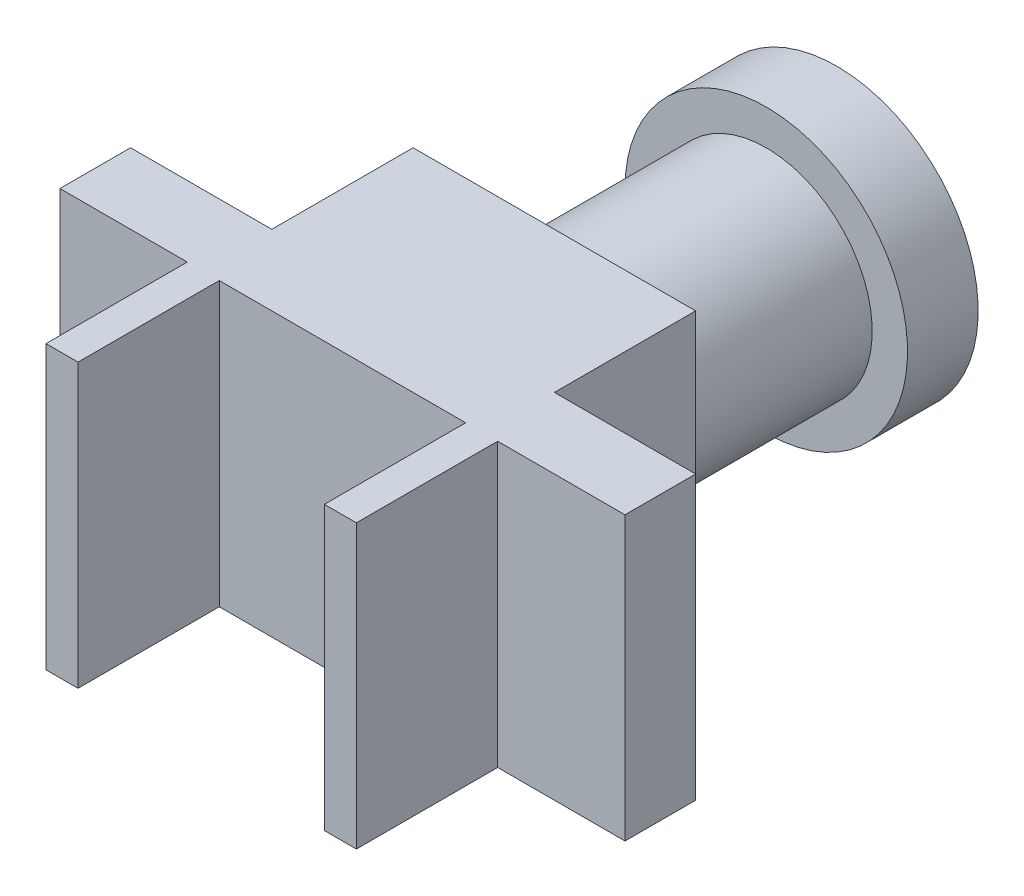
SolidWorks part; units mm, degrees
ref_plane "Front Plane" through (0, 0, 0) normal (0, 0, 1) x (1, 0, 0)
ref_plane "Top Plane" through (0, 0, 0) normal (0, 1, 0) x (1, 0, 0)
ref_plane "Right Plane" through (0, 0, 0) normal (1, 0, 0) x (0, 0, -1)
sketch "Sketch1" plane through (0, 0, 0) normal (0, 0, 1) x (1, 0, 0)
  circle A0 centre (0, 0) radius 15
  dimension "D1" = 30
extrude "Boss-Extrude1" add sketch "Sketch1" along normal mid plane 30
sketch "Sketch2" plane through (0, 0, -15) normal (0, 0, -1) x (-1, 0, 0)
  circle A2 centre (0, 0) radius 20
  circle A3 centre (0, 0) radius 20
  dimension "D1" = 5
extrude "Boss-Extrude2" add sketch "Sketch2" along normal blind 10
sketch "Sketch3" plane through (0, 0, 15) normal (0, 0, 1) x (1, 0, 0)
  line L1 (20, 20) -> (-20, 20)
  line L2 (20, 20) -> (20, -20)
  line L3 (20, -20) -> (-20, -20)
  line L4 (-20, 20) -> (-20, -20)
  line L5 (20, 20) -> (-20, -20) construction
  line L6 (20, -20) -> (-20, 20) construction
  point P0 (0, 0)
  dimension "D1" = 40
  dimension "D2" = 40
extrude "Boss-Extrude3" add sketch "Sketch3" along normal blind 20
sketch "Sketch4" plane through (0, 0, 35) normal (0, 0, 1) x (1, 0, 0)
  line L1 (40, 20) -> (-40, 20)
  line L2 (40, 20) -> (40, -20)
  line L3 (40, -20) -> (-40, -20)
  line L4 (-40, 20) -> (-40, -20)
  line L5 (40, 20) -> (-40, -20) construction
  line L6 (40, -20) -> (-40, 20) construction
  point P0 (0, 0)
  dimension "D1" = 40
  dimension "D2" = 80
extrude "Boss-Extrude4" add sketch "Sketch4" along normal blind 10
sketch "Sketch5" plane through (0, 0, 45) normal (0, 0, 1) x (1, 0, 0)
  line L0 (40, 20) -> (-40, 20) construction
  line L1 (-21.9709, 20) -> (-17.4394, 20)
  line L2 (-21.9709, 20) -> (-21.9709, -20)
  line L3 (-21.9709, -20) -> (-17.4394, -20)
  line L4 (-17.4394, 20) -> (-17.4394, -20)
  line L5 (-40, -20) -> (40, -20) construction
extrude "Boss-Extrude5" add sketch "Sketch5" along normal blind 20
mirror "Mirror1" about plane through (0, 0, 0) normal (1, 0, 0) of "Boss-Extrude5"
